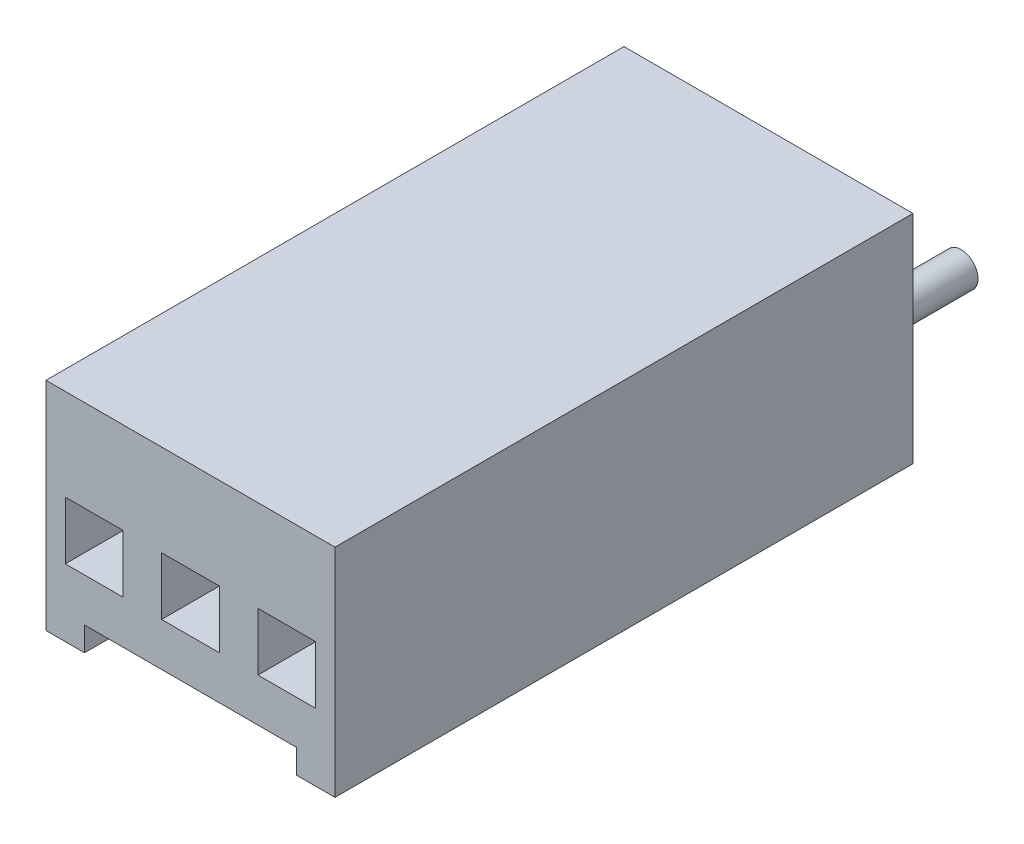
SolidWorks part; units mm, degrees
ref_plane "Front Plane" through (0, 0, 0) normal (0, 0, 1) x (1, 0, 0)
ref_plane "Top Plane" through (0, 0, 0) normal (0, 1, 0) x (1, 0, 0)
ref_plane "Right Plane" through (0, 0, 0) normal (1, 0, 0) x (0, 0, -1)
sketch "Sketch2" plane through (0, 0, 0) normal (0, 0, 1) x (1, 0, 0)
  line L1 (-1.27, 3.175) -> (6.35, 3.175)
  line L2 (-1.27, 3.175) -> (-1.27, -2.54)
  line L3 (-1.27, -2.54) -> (6.35, -2.54)
  line L4 (6.35, 3.175) -> (6.35, -2.54)
extrude "Boss-Extrude2" add sketch "Sketch2" along normal blind 2.54
sketch "Sketch3" plane through (0, 0, 2.54) normal (0, 0, 1) x (1, 0, 0)
  line L0 (-1.27, -2.54) -> (6.35, -2.54) construction
  line L1 (0, -2.54) -> (5.08, -2.54)
  line L2 (0, -2.54) -> (0, -1.905)
  line L3 (0, -1.905) -> (5.08, -1.905)
  line L4 (5.08, -2.54) -> (5.08, -1.905)
extrude "Boss-Extrude3" add sketch "Sketch3" along normal blind 7.62
sketch "Sketch4" plane through (0, 0, 2.54) normal (0, 0, 1) x (1, 0, 0)
  line L0 (6.35, -2.54) -> (6.35, 3.175) construction
  line L1 (-1.27, 3.175) -> (6.35, 3.175)
  line L2 (-1.27, 3.175) -> (-1.27, -1.905)
  line L3 (-1.27, -1.905) -> (6.35, -1.905)
  line L4 (6.35, 3.175) -> (6.35, -1.905)
extrude "Boss-Extrude4" add sketch "Sketch4" along normal blind 12.7
sketch "Sketch5" plane through (0, 0, 0) normal (0, 0, -1) x (-1, 0, 0)
  circle A0 centre (0, 0) radius 0.4445
  circle A1 centre (-2.54, 0) radius 0.4445
  circle A2 centre (-5.08, 0) radius 0.4445
extrude "Boss-Extrude5" add sketch "Sketch5" along normal blind 2.54
sketch "Эскиз2" plane through (0, -1.905, 0) normal (0, -1, 0) x (1, 0, 0)
  line L1 (-1.27, 15.24) -> (-0.254, 15.24)
  line L2 (-1.27, 15.24) -> (-1.27, 2.54)
  line L3 (-1.27, 2.54) -> (-0.254, 2.54)
  line L4 (-0.254, 15.24) -> (-0.254, 2.54)
  line L5 (5.334, 15.24) -> (6.35, 15.24)
  line L6 (5.334, 15.24) -> (5.334, 2.54)
  line L7 (5.334, 2.54) -> (6.35, 2.54)
  line L8 (6.35, 15.24) -> (6.35, 2.54)
extrude "Бобышка-Вытянуть1" add sketch "Эскиз2" along normal blind 0.635
sketch "Эскиз3" plane through (0, 0, 15.24) normal (0, 0, 1) x (1, 0, 0)
  line L1 (-0.762, 0.762) -> (0.762, 0.762)
  line L2 (-0.762, 0.762) -> (-0.762, -0.762)
  line L3 (-0.762, -0.762) -> (0.762, -0.762)
  line L4 (0.762, 0.762) -> (0.762, -0.762)
  line L5 (1.778, 0.762) -> (3.302, 0.762)
  line L6 (1.778, 0.762) -> (1.778, -0.762)
  line L7 (1.778, -0.762) -> (3.302, -0.762)
  line L8 (3.302, 0.762) -> (3.302, -0.762)
  line L9 (4.318, -0.762) -> (5.842, -0.762)
  line L10 (4.318, -0.762) -> (4.318, 0.762)
  line L11 (4.318, 0.762) -> (5.842, 0.762)
  line L12 (5.842, -0.762) -> (5.842, 0.762)
extrude "Вырез-Вытянуть1" cut sketch "Эскиз3" against normal blind 12.7
